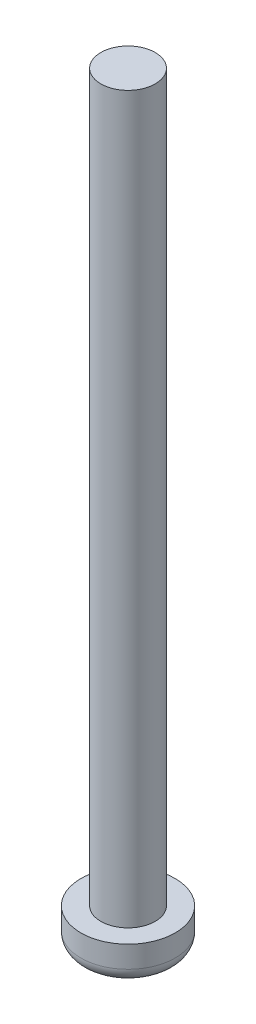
SolidWorks part; units mm, degrees
ref_plane "Front" through (0, 0, 0) normal (0, 0, 1) x (1, 0, 0)
ref_plane "Top" through (0, 0, 0) normal (0, 1, 0) x (1, 0, 0)
ref_plane "Right" through (0, 0, 0) normal (1, 0, 0) x (0, 0, -1)
sketch "Sketch1" plane through (0, 0, 0) normal (0, 1, 0) x (1, 0, 0)
  circle A0 centre (0, 0) radius 4.7625
extrude "Extrude1" add sketch "Sketch1" along normal blind 127
sketch "Sketch2" plane through (0, 0, 0) normal (0, -1, 0) x (1, 0, 0)
  circle A0 centre (0, 0) radius 8.255
extrude "Extrude2" add sketch "Sketch2" along normal blind 6.35
fillet "Fillet1" radius 2.54 1 edges at (0, -6.35, -8.255)
